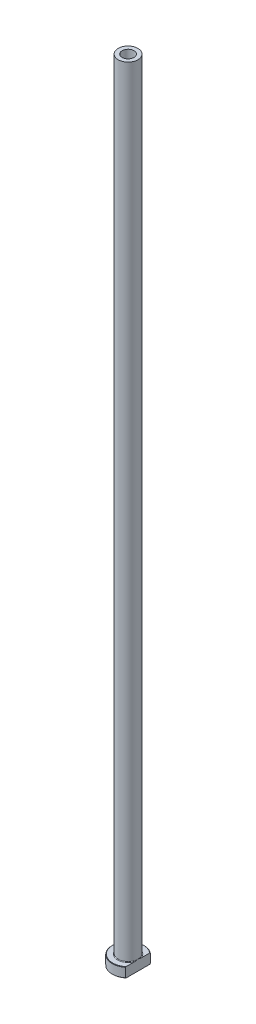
SolidWorks part; units mm, degrees
ref_plane "Front Plane" through (0, 0, 0) normal (0, 0, 1) x (1, 0, 0)
ref_plane "Top Plane" through (0, 0, 0) normal (0, 1, 0) x (1, 0, 0)
ref_plane "Right Plane" through (0, 0, 0) normal (1, 0, 0) x (0, 0, -1)
sketch "Sketch1" plane through (0, 0, 0) normal (0, 0, 1) x (1, 0, 0)
  line L0 (-3, 400) -> (-5, 400)
  line L1 (-5, 400) -> (-5, 5)
  line L2 (-5, 5) -> (-8, 5)
  line L3 (-8, 5) -> (-8, 0)
  line L4 (7.15, 0) -> (-7.15, 0) construction
  line L5 (-8, 0) -> (-3.25, 0)
  line L6 (-3, 355) -> (-3, 400)
  line L7 (0, 92.1877) -> (0, -15.5353) construction
  line L8 (0, -8.8) -> (0, 8.8) construction
  line L9 (-3, 355) -> (-3.25, 343)
  line L10 (-3.25, 343) -> (-3.25, 0)
  dimension "D1" = 0.25
  dimension "ID" = 6
  dimension "OD" = 10
  dimension "L" = 400
  dimension "H" = 16
  dimension "T" = 5
  dimension "N" = 45
  dimension "D2" = 12
  dimension "L-N" = 355
revolve "Revolve1" add sketch "Sketch1" angle 360 about L7
fillet "Fillet1" radius 0.3 1 edges at (0, 5, 5)
chamfer "Chamfer1" distance 0.2 angle 45 2 edges at (0, 5, 8) (0, 0, 8)
sketch "Sketch2" plane through (0, 0, 0) normal (0, -1, 0) x (1, 0, 0)
  line L0 (5, 6.245) -> (5, -6.245)
  circle A0 centre (0, 0) radius 8 construction
  arc A1 (5, 6.245) -> (5, -6.245) centre (0, 0) cw
  circle A2 centre (0, 0) radius 5 construction
extrude "Cut-Extrude1" cut sketch "Sketch2" against normal through all
chamfer "Chamfer2" distance 0.5 angle 45 1 edges at (0, 0, 3.25)
